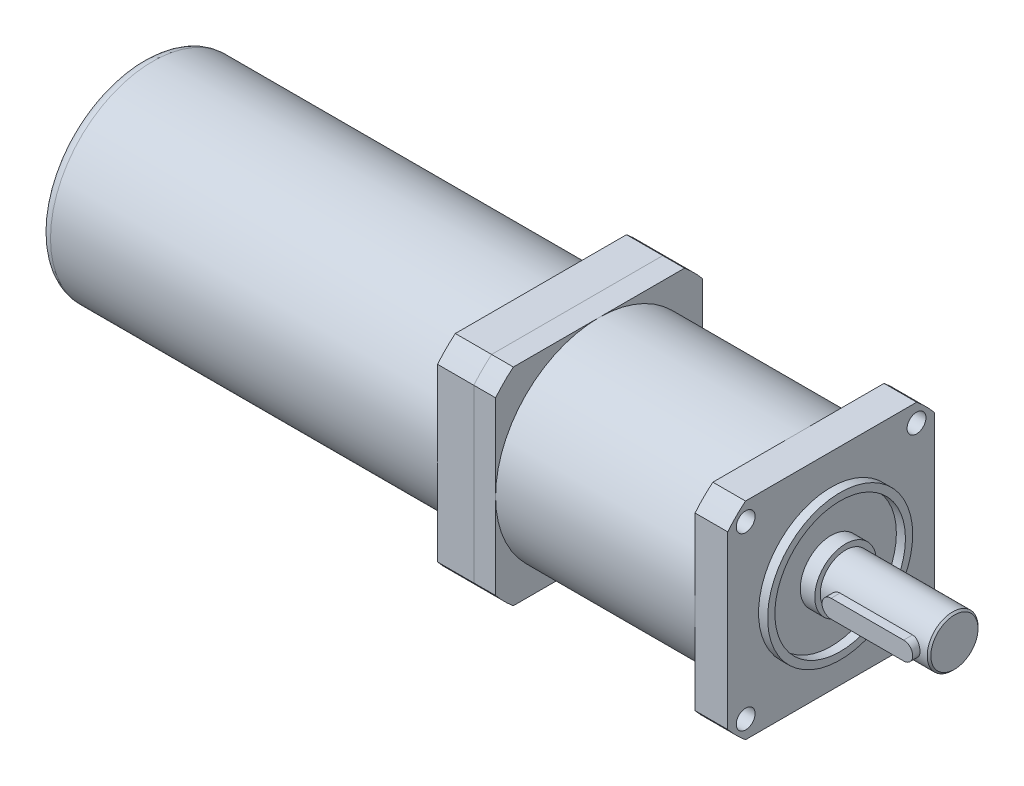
SolidWorks part; units mm, degrees
ref_plane "前视基准面" through (0, 0, 0) normal (0, 0, 1) x (1, 0, 0)
ref_plane "上视基准面" through (0, 0, 0) normal (0, 1, 0) x (1, 0, 0)
ref_plane "右视基准面" through (0, 0, 0) normal (1, 0, 0) x (0, 0, -1)
sketch "草图1" plane through (0, 0, 0) normal (1, 0, 0) x (0, 0, -1)
  line L1 (-23.5956, -28.5) -> (23.5956, -28.5)
  line L2 (-28.5, -23.5956) -> (-28.5, 23.5956)
  line L3 (-23.5956, 28.5) -> (23.5956, 28.5)
  line L4 (28.5, -23.5956) -> (28.5, 23.5956)
  line L5 (-26.163, -26.163) -> (26.163, 26.163) construction
  line L6 (-26.163, 26.163) -> (26.163, -26.163) construction
  arc A0 (-28.5, -23.5956) -> (-23.5956, -28.5) centre (0, 0) ccw
  arc A1 (-23.5956, 28.5) -> (-28.5, 23.5956) centre (0, 0) ccw
  arc A2 (28.5, 23.5956) -> (23.5956, 28.5) centre (0, 0) ccw
  arc A3 (23.5956, -28.5) -> (28.5, -23.5956) centre (0, 0) ccw
  point P0 (0, 0)
extrude "凸台-拉伸1" add sketch "草图1" against normal blind 9
sketch "草图2" plane through (-9, 0, 0) normal (-1, 0, 0) x (0, 0, 1)
  circle A0 centre (0, 0) radius 28.5
extrude "凸台-拉伸2" add sketch "草图2" along normal blind 55
sketch "草图3" plane through (-64, 0, 0) normal (-1, 0, 0) x (0, 0, 1)
  line L1 (-23.5956, -28.5) -> (23.5956, -28.5)
  line L2 (-28.5, -23.5956) -> (-28.5, 23.5956)
  line L3 (-23.5956, 28.5) -> (23.5956, 28.5)
  line L4 (28.5, -23.5956) -> (28.5, 23.5956)
  line L5 (-26.163, -26.163) -> (26.163, 26.163) construction
  line L6 (-26.163, 26.163) -> (26.163, -26.163) construction
  arc A0 (-28.5, -23.5956) -> (-23.5956, -28.5) centre (0, 0) ccw
  arc A1 (23.5956, -28.5) -> (28.5, -23.5956) centre (0, 0) ccw
  arc A2 (28.5, 23.5956) -> (23.5956, 28.5) centre (0, 0) ccw
  arc A3 (-23.5956, 28.5) -> (-28.5, 23.5956) centre (0, 0) ccw
  point P0 (0, 0)
extrude "凸台-拉伸3" add sketch "草图3" along normal blind 6
sketch "草图6" plane through (0, 0, 0) normal (1, 0, 0) x (0, 0, -1)
  circle A0 centre (-23.55, 23.55) radius 2.6
  circle A1 centre (23.55, 23.55) radius 2.6
  circle A2 centre (23.55, -23.55) radius 2.6
  circle A3 centre (-23.55, -23.55) radius 2.6
  point P0 (0, 0)
extrude "切除-拉伸2" cut sketch "草图6" against normal blind 9
sketch "草图7" plane through (0, 0, 0) normal (1, 0, 0) x (0, 0, -1)
  circle A0 centre (0, 0) radius 20
  circle A1 centre (0, 0) radius 18
extrude "凸台-拉伸5" add sketch "草图7" along normal blind 2.5
sketch "草图8" plane through (0, 0, 0) normal (1, 0, 0) x (0, 0, -1)
  circle A0 centre (0, 0) radius 8.5
extrude "凸台-拉伸6" add sketch "草图8" along normal blind 4
sketch "草图9" plane through (4, 0, 0) normal (1, 0, 0) x (0, 0, -1)
  circle A0 centre (0, 0) radius 7
extrude "凸台-拉伸7" add sketch "草图9" along normal blind 30
ref_plane "基准面1" through (0, 0, 7) normal (0, 0, 1) x (1, 0, 0)
sketch "草图10" plane through (0, 0, 7) normal (0, 0, 1) x (1, 0, 0)
  line L3 (9, 2.5) -> (29, 2.5)
  line L5 (29, -2.5) -> (9, -2.5)
  arc A0 (29, -2.5) -> (29, 2.5) centre (29, 0) ccw
  arc A1 (9, 2.5) -> (9, -2.5) centre (9, 0) ccw
extrude "切除-拉伸3" cut sketch "草图10" against normal blind 3
sketch "草图11" plane through (0, 0, 4) normal (0, 0, 1) x (1, 0, 0)
  line L0 (9, 2.5) -> (29, 2.5)
  line L2 (29, -2.5) -> (9, -2.5)
  arc A0 (9, 2.5) -> (9, -2.5) centre (9, 0) ccw
  arc A1 (29, -2.5) -> (29, 2.5) centre (29, 0) ccw
extrude "凸台-拉伸8" add sketch "草图11" along normal blind 5
chamfer "倒角1" distance 0.5 angle 45 1 edges at (34, 0, -7)
sketch "草图14" plane through (-70, 0, 0) normal (-1, 0, 0) x (0, 0, 1)
  line L1 (-23.5956, -28.5) -> (23.5956, -28.5)
  line L2 (-28.5, -23.5956) -> (-28.5, 23.5956)
  line L3 (-23.5956, 28.5) -> (23.5956, 28.5)
  line L4 (28.5, -23.5956) -> (28.5, 23.5956)
  line L5 (-26.163, -26.163) -> (26.163, 26.163) construction
  line L6 (-26.163, 26.163) -> (26.163, -26.163) construction
  arc A0 (-23.5956, 28.5) -> (-28.5, 23.5956) centre (0, 0) ccw
  arc A1 (-28.5, -23.5956) -> (-23.5956, -28.5) centre (0, 0) ccw
  arc A2 (23.5956, -28.5) -> (28.5, -23.5956) centre (0, 0) ccw
  arc A3 (28.5, 23.5956) -> (23.5956, 28.5) centre (0, 0) ccw
  point P0 (0, 0)
extrude "凸台-拉伸9" add sketch "草图14" along normal blind 10 separate body
sketch "草图15" plane through (-80, 0, 0) normal (-1, 0, 0) x (0, 0, 1)
  circle A0 centre (0, 0) radius 28.2
extrude "凸台-拉伸10" add sketch "草图15" along normal blind 110
fillet "圆角1" radius 3 1 edges at (-190, 0, 28.2)
